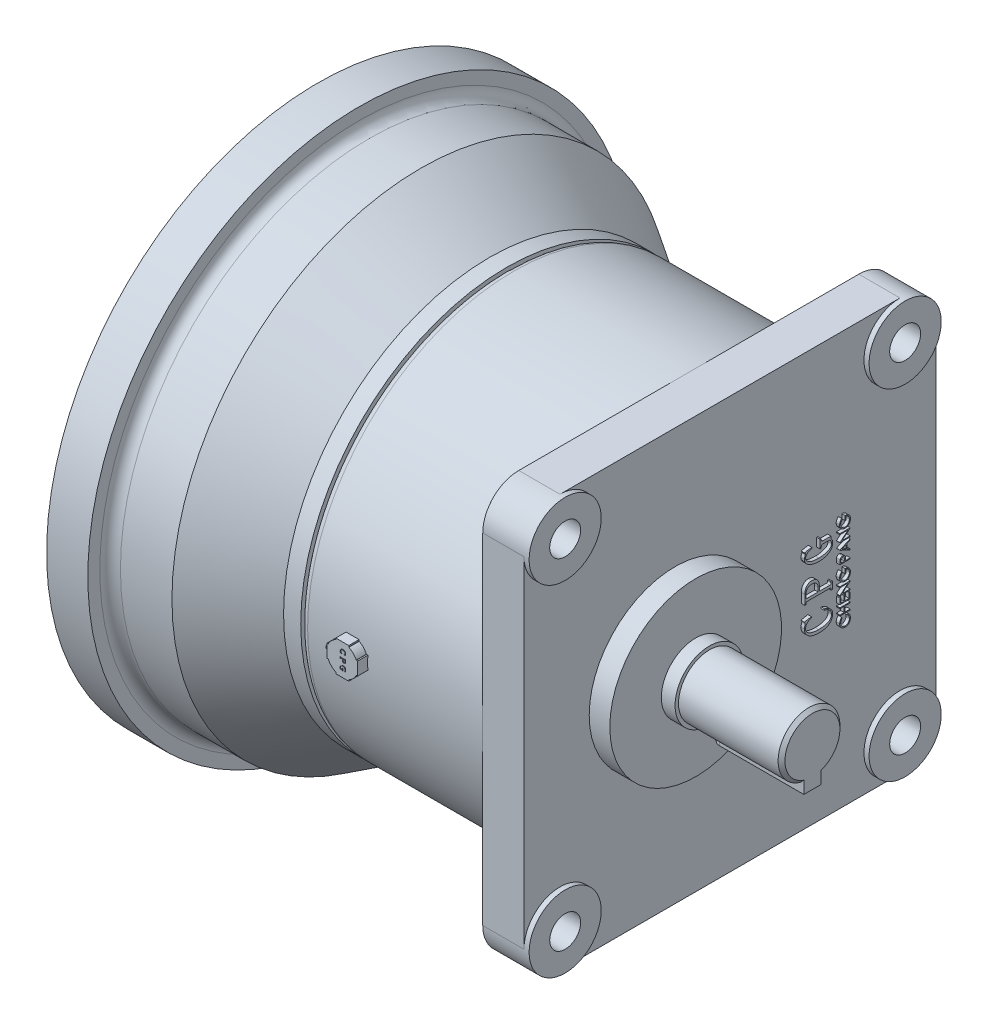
SolidWorks part; units mm, degrees
ref_plane "前视基准面" through (0, 0, 0) normal (0, 0, 1) x (1, 0, 0)
ref_plane "上视基准面" through (0, 0, 0) normal (0, 1, 0) x (1, 0, 0)
ref_plane "右视基准面" through (0, 0, 0) normal (1, 0, 0) x (0, 0, -1)
sketch "草图1" plane through (0, 0, 0) normal (0, 1, 0) x (1, 0, 0)
  line L0 (0, 0) -> (15.7361, 0) construction
  line L1 (0, 0) -> (0, -9)
  line L2 (0, -9) -> (-30, -9)
  line L3 (-30, -9) -> (-30, -10)
  line L4 (-30, -10) -> (-34, -10)
  line L5 (-34, -10) -> (-34, -25)
  line L6 (-34, -25) -> (-40, -25)
  line L7 (-40, -25) -> (-40, 0)
  line L8 (-40, 0) -> (0, 0)
  dimension "D1" = 30
  dimension "D2" = 18
  dimension "D3" = 20
  dimension "D4" = 6
  dimension "D5" = 50
  dimension "D6" = 40
revolve "旋转1" add sketch "草图1" angle 360 about L0
sketch "草图2" plane through (0, 0, 0) normal (0, 1, 0) x (1, 0, 0)
  line L0 (8.0167, 16) -> (-52, 16) construction
  line L1 (-40, 25) -> (-40, -25) construction
  line L4 (-52, 16) -> (-52, -44)
  line L5 (-52, -44) -> (-105, -44)
  line L6 (-105, 16) -> (-105, -44)
  line L11 (-52, 16) -> (-105, 16)
  dimension "D1" = 16
  dimension "D2" = 12
  dimension "D3" = 120
  dimension "D5" = 53
revolve "旋转2" add sketch "草图2" angle 360 about L0
sketch "草图12" plane through (-52, 0, 0) normal (1, 0, 0) x (0, 0, -1)
  line L0 (-44, -60) -> (76, 60) construction
  line L1 (-44, -60) -> (76, -60)
  line L2 (-44, -60) -> (-44, 60)
  line L3 (-44, 60) -> (76, 60)
  line L4 (76, -60) -> (76, 60)
  line L5 (-44, 60) -> (76, -60) construction
  circle A0 centre (16, 0) radius 60 construction
  point P4 (16, 0)
  dimension "D1" = 120
  dimension "D2" = 120
extrude "拉伸8" add sketch "草图12" along normal up to surface (12 mm away)
sketch "草图5" plane through (0, 0, 0) normal (0, 1, 0) x (1, 0, 0)
  line L0 (0, -2.5) -> (-24.5, -2.5)
  line L1 (0, -9) -> (0, 9) construction
  line L2 (-24.5, 2.5) -> (0, 2.5)
  line L3 (0, 2.5) -> (0, -2.5)
  line L4 (20.2, -13.7955) -> (20.2, 19.6443) construction
  arc A0 (-24.5, -2.5) -> (-24.5, 2.5) centre (-24.5, 0) cw
  dimension "D2" = 27
  dimension "D1" = 5
  dimension "D3" = 20.2
extrude "拉伸4" add sketch "草图5" against normal blind 11.2
fillet "圆角1" radius 2 1 edges at (-105, 0, -76)
chamfer "倒角1" distance 1 angle 45 1 edges at (0, 9, 0)
fillet "圆角3" radius 10.5 4 edges at (-46, 60, -76) (-46, -60, -76) (-46, -60, 44) (-46, 60, 44)
sketch "草图14" plane through (-40, 0, 0) normal (1, 0, 0) x (0, 0, -1)
  line L0 (-33.5, 60) -> (65.5, 60) construction
  line L1 (-44, -49.5) -> (-44, 49.5) construction
  line L2 (65.5, -60) -> (-33.5, -60) construction
  line L3 (76, 49.5) -> (76, -49.5) construction
  circle A0 centre (-33.5, 49.5) radius 10.5
  circle A1 centre (65.5, 49.5) radius 10.5
  circle A2 centre (-33.5, -49.5) radius 10.5
  circle A3 centre (65.5, -49.5) radius 10.5
  dimension "D1" = 21
extrude "拉伸10" add sketch "草图14" along normal blind 1.5
sketch "草图13" plane through (-38.5, 0, 0) normal (1, 0, 0) x (0, 0, -1)
  line L0 (-33.5, 49.4949) -> (65.5, 49.4949) construction
  line L1 (0, 0) -> (40.9287, 0) construction
  line L2 (-33.5, 60) -> (65.5, 60) construction
  circle A0 centre (-33.5, 49.4949) radius 4.5
  circle A1 centre (65.5, -49.4949) radius 4.5
  circle A2 centre (65.5, 49.4949) radius 4.5
  circle A3 centre (-33.5, -49.4949) radius 4.5
  circle A4 centre (16, 0) radius 70 construction
  dimension "D1" = 33.5
  dimension "D2" = 65.5
  dimension "D4" = 9
  dimension "D3" = 140
extrude "切除-拉伸3" cut sketch "草图13" against normal blind 15
sketch "草圖1" plane through (0, 0, 0) normal (0, 1, 0) x (1, 0, 0)
  line L0 (-105, 16) -> (-152.5, 16)
  line L1 (-105, -44) -> (-105, 16)
  line L2 (-8.3334, 16) -> (-180.5704, 16) construction
  line L4 (-105, -44) -> (-110, -44)
  line L5 (-110, -44) -> (-130, -56.5)
  line L6 (-130, -56.5) -> (-145, -56.5)
  line L7 (-148, -59.5) -> (-148, -63)
  line L8 (-148, -63) -> (-160, -63)
  line L9 (-160, -63) -> (-160, -40)
  line L10 (-159, -39) -> (-156, -39)
  line L11 (-156, -39) -> (-156, -34.0871)
  line L12 (-135, -23.5606) -> (-135, -18)
  line L13 (-138, -15) -> (-153, -15)
  line L14 (-154, -14) -> (-154, -5)
  line L15 (-154, -5) -> (-152.8, -5)
  line L16 (-152.5, -4.7) -> (-152.5, 16)
  line L17 (-155.9137, -33.988) -> (-135, -31.0869)
  line L18 (0, -2.5) -> (0, 2.5) construction
  arc A0 (-145, -56.5) -> (-148, -59.5) centre (-145, -59.5) ccw
  arc A1 (-135, -31.0869) -> (-133.7461, -26.0001) centre (-135.3875, -28.2934) ccw
  arc A2 (-159, -39) -> (-160, -40) centre (-159, -40) ccw
  arc A3 (-155.9137, -33.988) -> (-156, -34.0871) centre (-155.9, -34.0871) ccw
  arc A4 (-133.7461, -26.0001) -> (-135, -23.5606) centre (-132, -23.5606) cw
  arc A5 (-135, -18) -> (-138, -15) centre (-138, -18) ccw
  arc A6 (-153, -15) -> (-154, -14) centre (-153, -14) cw
  arc A7 (-152.8, -5) -> (-152.5, -4.7) centre (-152.8, -4.7) ccw
  point P4 (0, 0)
  point P27 (-160, -39)
  point P29 (0, 0)
  point P30 (-156, -34)
  point P33 (-135, -25.5)
  point P38 (-154, -15)
  point P41 (-154, -4)
  dimension "D9" = 158
  dimension "D19" = 16
  dimension "D20" = 160
  dimension "D2" = 120
  dimension "D3" = 105
  dimension "D7" = 55
  dimension "D8" = 145
  dimension "D10" = 110
revolve "旋轉1" add sketch "草圖1" angle 360 about L2
sketch "草圖3" plane through (-160, 0, 0) normal (-1, 0, 0) x (0, 0, 1)
  line L0 (-100.0945, 0) -> (72.8288, 0) construction
  line L1 (-16, 84.2191) -> (-16, -84.9666) construction
  circle A0 centre (-16, 0) radius 65 construction
  circle A1 centre (-61.9619, 45.9619) radius 4
  circle A2 centre (29.9619, 45.9619) radius 4
  circle A3 centre (29.9619, -45.9619) radius 4
  circle A4 centre (-61.9619, -45.9619) radius 4
  dimension "D1" = 130
  dimension "D2" = 8
extrude "伸長1" cut sketch "草圖3" against normal blind 25
sketch "草圖7" plane through (-160, 0, 0) normal (-1, 0, 0) x (0, 0, 1)
  line L0 (-15.7357, 0.1095) -> (-81.9995, 0.1095) construction
  line L1 (-76.8691, 25.8875) -> (-57.1652, 5.6346)
  line L2 (-76.8691, -25.14) -> (-57.1013, -5.3652)
  line L3 (-56.1598, 10.8351) -> (-63.2309, 17.9061)
  line L4 (-33.5324, 47.6046) -> (-26.4613, 40.5336)
  line L5 (-62.4923, 35.1988) -> (-50.825, 46.866)
  line L6 (-41.5138, 61.2429) -> (-21.739, 41.475)
  line L7 (9.5138, 61.2429) -> (-10.7392, 41.539)
  line L8 (18.825, 46.866) -> (30.4923, 35.1988)
  line L10 (31.2309, 17.9061) -> (24.1598, 10.8351)
  line L11 (44.8691, 25.8875) -> (25.1013, 6.1127)
  line L12 (44.8691, -25.14) -> (25.1652, -4.8871)
  line L13 (30.4923, -34.4513) -> (18.825, -46.1185)
  line L15 (1.5324, -46.8571) -> (-5.5387, -39.7861)
  line L16 (9.5138, -60.4954) -> (-10.261, -40.7275)
  line L17 (-41.5138, -60.4954) -> (-21.2608, -40.7914)
  line L18 (-50.825, -46.1185) -> (-62.4923, -34.4513)
  line L20 (-63.2309, -17.1586) -> (-56.1598, -10.0876)
  line L22 (-5.5387, 40.5336) -> (1.5324, 47.6046)
  line L24 (24.1598, -10.0876) -> (31.2309, -17.1586)
  line L29 (-26.4613, -39.7861) -> (-33.5324, -46.8571)
  arc A0 (-76.8691, 25.8875) -> (-76.8691, -25.14) centre (-16, 0.3738) ccw
  arc A1 (-26.4613, 40.5336) -> (-56.1598, 10.8351) centre (-16, 0.3738) ccw
  arc A2 (24.1598, 10.8351) -> (-5.5387, 40.5336) centre (-16, 0.3738) ccw
  arc A3 (-57.1652, 5.6346) -> (-57.1013, -5.3652) centre (-16, 0.3738) ccw
  arc A4 (9.5138, 61.2429) -> (-41.5138, 61.2429) centre (-16, 0.3738) ccw
  arc A5 (-10.7392, 41.539) -> (-21.739, 41.475) centre (-16, 0.3738) ccw
  arc A6 (-5.5387, -39.7861) -> (24.1598, -10.0876) centre (-16, 0.3738) ccw
  arc A7 (44.8691, -25.14) -> (44.8691, 25.8875) centre (-16, 0.3738) ccw
  arc A8 (25.1652, -4.8871) -> (25.1013, 6.1127) centre (-16, 0.3738) ccw
  arc A9 (-56.1598, -10.0876) -> (-26.4613, -39.7861) centre (-16, 0.3738) ccw
  arc A10 (-41.5138, -60.4954) -> (9.5138, -60.4954) centre (-16, 0.3738) ccw
  arc A11 (-21.2608, -40.7914) -> (-10.261, -40.7275) centre (-16, 0.3738) ccw
  spline S0 degree 2 poles (-63.2309, 17.9061) (-68.0713, 26.7678) (-62.4923, 35.1988) knots 0 0 0 1 1 1
  spline S1 degree 2 poles (-33.5324, 47.6046) (-42.3941, 52.445) (-50.825, 46.866) knots 0 0 0 1 1 1
  spline S2 degree 2 poles (31.2309, 17.9061) (36.0713, 26.7678) (30.4923, 35.1988) knots 0 0 0 1 1 1
  spline S3 degree 2 poles (1.5324, 47.6046) (10.3941, 52.445) (18.825, 46.866) knots 0 0 0 1 1 1
  spline S4 degree 2 poles (1.5324, -46.8571) (10.3941, -51.6975) (18.825, -46.1185) knots 0 0 0 1 1 1
  spline S5 degree 2 poles (31.2309, -17.1586) (36.0713, -26.0203) (30.4923, -34.4513) knots 0 0 0 1 1 1
  spline S6 degree 2 poles (-63.2309, -17.1586) (-68.0713, -26.0203) (-62.4923, -34.4513) knots 0 0 0 1 1 1
  spline S7 degree 2 poles (-33.5324, -46.8571) (-42.3941, -51.6975) (-50.825, -46.1185) knots 0 0 0 1 1 1
extrude "伸長2" cut sketch "草圖7" against normal blind 39
sketch "草圖8" plane through (-121, 0, 0) normal (-1, 0, 0) x (0, 0, 1)
  circle A0 centre (-16, 0) radius 51.5 construction
  circle A1 centre (-52.416, 36.416) radius 3
  circle A2 centre (20.416, 36.416) radius 3
  circle A3 centre (20.416, -36.416) radius 3
  circle A4 centre (-52.416, -36.416) radius 3
  dimension "D1" = 103
  dimension "D2" = 6
extrude "伸長3" cut sketch "草圖8" against normal blind 11
sketch "草圖9" plane through (-152.5, 0, 0) normal (-1, 0, 0) x (0, 0, 1)
  line L0 (-16, -16.5253) -> (-16, 16) construction
  line L3 (-33.7414, 0) -> (0.5842, 0) construction
  line L5 (-8.7, 2) -> (-8.7, -2)
  line L6 (-8.7, -2) -> (-10.8765, -2)
  line L7 (-8.7, 2) -> (-10.8765, 2)
  circle A0 centre (-16, 0) radius 12.5 construction
  arc A1 (-10.8765, 2) -> (-10.8765, -2) centre (-16, 0) ccw
  dimension "D1" = 25
  dimension "D2" = 11
  dimension "D3" = 7.3
  dimension "D4" = 4
extrude "伸長4" cut sketch "草圖9" against normal blind 28
sketch "草圖11" plane through (-152.5, 0, 0) normal (-1, 0, 0) x (0, 0, 1)
  line L3 (-8.7, 2) -> (-10.8765, 2)
  line L4 (-8.7, -2) -> (-8.7, 2)
  line L5 (-10.8765, -2) -> (-8.7, -2)
  line L6 (-8.7, 2) -> (-10.8765, 2)
  line L7 (-8.7, -2) -> (-8.7, 2)
  line L8 (-10.8765, -2) -> (-8.7, -2)
  circle A0 centre (-16, 0) radius 12.5 construction
  arc A1 (-10.8765, 2) -> (-10.8765, -2) centre (-16, 0) ccw
  arc A2 (-10.8765, 2) -> (-10.8765, -2) centre (-16, 0) ccw
  circle A3 centre (-16, 0) radius 12.5
  dimension "D1" = 0
extrude "伸長5" add sketch "草圖11" along normal blind 1
sketch "草圖12"
  dimension "D1" = 45
  dimension "D2" = 50
  dimension "D3" = 60
  dimension "D4" = 30
extrude "伸長6" add sketch "草圖12" along normal blind 1
ref_plane "平面1" through (0, 0, 46.9) normal (0, 0, 1) x (1, 0, 0)
sketch "草圖13" plane through (0, 0, 46.9) normal (0, 0, 1) x (1, 0, 0)
  line L0 (-91.8947, 4.5) -> (-88.1053, 4.5)
  line L2 (-91.8947, 4.1268) -> (-91.8947, 4.5)
  line L3 (-88.1053, 4.1268) -> (-88.1053, 4.5)
  line L4 (-94.1268, 1.8947) -> (-94.5, 1.8947)
  line L5 (-94.1268, -1.8947) -> (-94.5, -1.8947)
  line L6 (-94.5, -1.8947) -> (-94.5, 1.8947)
  line L7 (-91.8947, -4.1268) -> (-91.8947, -4.5)
  line L8 (-88.1053, -4.1268) -> (-88.1053, -4.5)
  line L9 (-88.1053, -4.5) -> (-91.8947, -4.5)
  line L10 (-85.8732, -1.8947) -> (-85.5, -1.8947)
  line L11 (-85.8732, 1.8947) -> (-85.5, 1.8947)
  line L12 (-85.5, 1.8947) -> (-85.5, -1.8947)
  arc A0 (-91.9352, 4.0626) -> (-94.0626, 1.9352) centre (-90, 0) ccw
  arc A1 (-91.9352, 4.0626) -> (-91.8947, 4.1268) centre (-91.9658, 4.1268) ccw
  arc A2 (-88.1053, 4.1268) -> (-88.0648, 4.0626) centre (-88.0342, 4.1268) ccw
  arc A3 (-94.1268, 1.8947) -> (-94.0626, 1.9352) centre (-94.1268, 1.9658) ccw
  arc A4 (-94.0626, -1.9352) -> (-94.1268, -1.8947) centre (-94.1268, -1.9658) ccw
  arc A5 (-91.8947, -4.1268) -> (-91.9352, -4.0626) centre (-91.9658, -4.1268) ccw
  arc A6 (-88.0648, -4.0626) -> (-88.1053, -4.1268) centre (-88.0342, -4.1268) ccw
  arc A7 (-85.8732, -1.8947) -> (-85.9374, -1.9352) centre (-85.8732, -1.9658) ccw
  arc A8 (-85.9374, 1.9352) -> (-85.8732, 1.8947) centre (-85.8732, 1.9658) ccw
  arc A9 (-94.0626, -1.9352) -> (-91.9352, -4.0626) centre (-90, 0) ccw
  arc A10 (-88.0648, -4.0626) -> (-85.9374, -1.9352) centre (-90, 0) ccw
  arc A11 (-85.9374, 1.9352) -> (-88.0648, 4.0626) centre (-90, 0) ccw
extrude "伸長7" add sketch "草圖13" against normal blind 3 separate body
sketch "草圖14"
extrude "伸長8" add sketch "草圖14" along normal blind 0.15
sketch "草圖16" plane through (0, 0, 0) normal (0, 1, 0) x (1, 0, 0)
  line L0 (-94.1689, -45.8828) -> (-92.4307, -45.7863)
  line L1 (-94.9414, -45.8828) -> (-94.1689, -45.8828)
  line L2 (-94.9414, -46.1725) -> (-94.9414, -45.8828)
  line L3 (-95.5208, -46.1725) -> (-95.5208, -45.4)
  line L4 (-95.5208, -46.1725) -> (-94.9414, -46.1725)
  line L5 (-92.4307, -45.7863) -> (-92.4307, -45.4)
  line L6 (-92.4307, -45.4) -> (-95.5208, -45.4)
  line L7 (-86.9, -46.9) -> (86.9, -46.9) construction
  dimension "D1" = 1.5
revolve "旋轉2" add sketch "草圖16" angle 360 about L6
equation "\"D1@拉伸4\" = \"D3@草图5\"-\"D2@草图1\"/2"
equation "\"D3@草图1\"=\"D2@草图1\"+2"
equation "\"D7@草圖1\" = \"D20@草圖1\"-\"D3@草圖1\""
